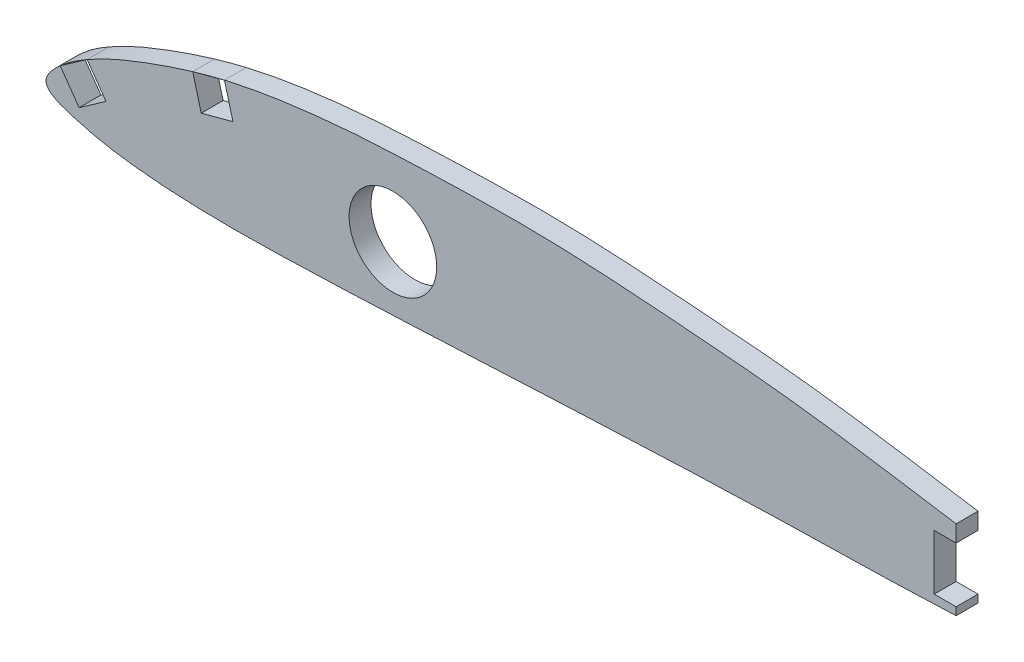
SolidWorks part; units mm, degrees
ref_plane "Front Plane" through (0, 0, 0) normal (0, 0, 1) x (1, 0, 0)
ref_plane "Top Plane" through (0, 0, 0) normal (0, 1, 0) x (1, 0, 0)
ref_plane "Right Plane" through (0, 0, 0) normal (1, 0, 0) x (0, 0, -1)
sketch3d "3DSketch1"
  spline S1 degree 3 poles (4.6792, -2.7787, 0) (-1.7289, -0.7599, 0) (2.0604, 3.1356, 0) (5.0574, 5.2821, 0) (8.9417, 7.3738, 0) (16.3804, 10.3996, 0) (25.404, 13.2786, 0) (36.0854, 14.9868, 0) (45.1384, 15.8902, 0) (57.189, 16.3953, 0) (72.2673, 16.823, 0) (90.3139, 15.5564, 0) (108.4908, 14.14, 0) (126.2552, 11.2943, 0) (145.3117, 8.381, 0) (159.8549, 4.9597, 0) (190.8126, -1.1725, 0) (150.7565, 0.2384, 0) (133.337, -1.3558, 0) (95.733, -1.9486, 0) (66.3381, -3.5503, 0) (36.0735, -4.8695, 0) (21.2, -5.1134, 0) (10.2525, -4.0531, 0) (4.6792, -2.7787, 0) (-1.7289, -0.7599, 0) (2.0604, 3.1356, 0) knots -0.051806 -0.027094 -0.014492 0 0.01056 0.018211 0.03221 0.045525 0.084069 0.108974 0.133649 0.158233 0.207343 0.256523 0.305826 0.355445 0.405214 0.45539 0.506007 0.555122 0.65337 0.70249 0.849939 0.899083 0.948194 0.972906 0.985508 1 1.01056 1.018211 1.03221 only from (0, 0, 0) to (0, 0, 0)
  dimension "D1" = 180.62
extrude "Boss-Extrude1" add sketch "3DSketch1" along direction (0, 0, 1) on the side of the normal blind 3.175
sketch "Sketch1" plane through (0, 0, 3.175) normal (0, 0, 1) x (1, 0, 0)
  line L0 (0, 0) -> (180.62, 0) construction
  line L1 (90.31, 0) -> (90.31, 5) construction
  line L2 (90.31, 5) -> (50.31, 5) construction
  line L3 (131.992, 0) -> (131.992, -9.0439)
  line L4 (131.992, 16.0032) -> (186.5006, 16.0032)
  line L5 (131.992, 16.0032) -> (131.992, 8)
  line L6 (131.992, -9.0439) -> (186.5006, -9.0439)
  line L7 (186.5006, 16.0032) -> (186.5006, -9.0439)
  line L8 (128.817, 8) -> (131.992, 8)
  line L9 (128.817, 8) -> (128.817, 0)
  line L10 (128.817, 0) -> (131.992, 0)
  line L11 (2.0644, 2.9916) -> (5.9656, 5.7232)
  line L12 (2.0644, 2.9916) -> (4.7961, -0.9097)
  line L13 (5.9656, 5.7232) -> (8.6973, 1.822)
  line L14 (4.7961, -0.9097) -> (8.6973, 1.822)
  line L15 (21.2823, 11.8554) -> (25.8825, 13.088)
  line L16 (21.2823, 11.8554) -> (22.515, 7.2552)
  line L17 (25.8825, 13.088) -> (27.1152, 8.4878)
  line L18 (22.515, 7.2552) -> (27.1152, 8.4878)
  circle A0 centre (50.31, 5) radius 6.35
  spline S0 degree 3 poles (2.0604, 3.1356) (-1.7289, -0.7599) (4.6792, -2.7787) (10.2525, -4.0531) (21.2, -5.1134) (36.0735, -4.8695) (66.3381, -3.5503) (95.733, -1.9486) (133.337, -1.3558) (150.7565, 0.2384) (190.8126, -1.1725) (159.8549, 4.9597) (145.3117, 8.381) (126.2552, 11.2943) (108.4908, 14.14) (90.3139, 15.5564) (72.2673, 16.823) (57.189, 16.3953) (45.1384, 15.8902) (36.0854, 14.9868) (25.404, 13.2786) (16.3804, 10.3996) (8.9417, 7.3738) (5.0574, 5.2821) (2.0604, 3.1356) (-1.7289, -0.7599) (4.6792, -2.7787) knots -0.03221 -0.018211 -0.01056 0 0.014492 0.027094 0.051806 0.100917 0.150061 0.29751 0.34663 0.444878 0.493993 0.54461 0.594786 0.644555 0.694174 0.743477 0.792657 0.841767 0.866351 0.891026 0.915931 0.954475 0.96779 0.981789 0.98944 1 1.014492 1.027094 1.051806 only from (0, 0) to (0, 0) construction
  dimension "D3" = 41.682
  dimension "D1" = 40
  dimension "D2" = 5
  dimension "D4" = 8
  dimension "D5" = 3.175
  dimension "D6" = 4.7625
  dimension "D7" = 4.7625
  dimension "D8" = 55
  dimension "D9" = 4.7625
  dimension "D10" = 4.7625
  dimension "D11" = 75
extrude "Cut-Extrude1" cut sketch "Sketch1" against normal blind 10
